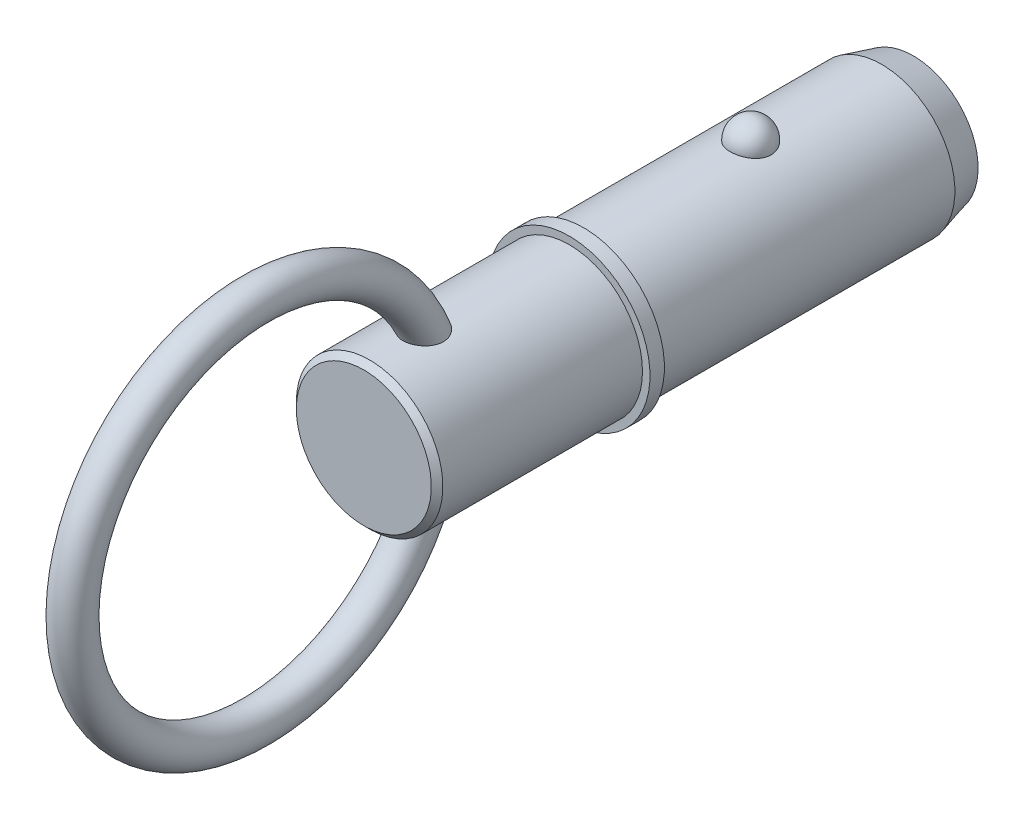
SolidWorks part; units mm, degrees
ref_plane "Front Plane" through (0, 0, 0) normal (0, 0, 1) x (1, 0, 0)
ref_plane "Top Plane" through (0, 0, 0) normal (0, 1, 0) x (1, 0, 0)
ref_plane "Right Plane" through (0, 0, 0) normal (1, 0, 0) x (0, 0, -1)
sketch "Sketch2" plane through (0, 0, 0) normal (0, 0, 1) x (1, 0, 0)
  circle A0 centre (0, 0) radius 12.7
  point P3 (0, 12.7)
  dimension "D1" = 25.4
extrude "Boss-Extrude1" add sketch "Sketch2" along normal blind 25.4
sketch "Sketch3" plane through (0, 0, 0) normal (0, 0, -1) x (-1, 0, 0)
  circle A0 centre (0, 0) radius 12.7
  dimension "D1" = 25.4
extrude "Boss-Extrude2" add sketch "Sketch3" along normal blind 31.75
chamfer "Chamfer1" distance 5.5 angle 15 1 edges at (-12.7, 0, -31.75)
sketch "Sketch18" plane through (0, 0, 0) normal (1, 0, 0) x (0, 0, -1)
  line L0 (26.25, 12.7) -> (-25.4, 12.7) construction
  line L1 (3.56, 16.26) -> (3.56, 9.14)
  line L2 (-25.4, -12.7) -> (26.25, -12.7) construction
  arc A0 (3.56, 16.26) -> (3.56, 9.14) centre (3.56, 12.7) ccw
  point P4 (0, 12.7)
  dimension "D1" = 28.96
revolve "Revolve1" add sketch "Sketch18" angle 360 about L1
sketch "Sketch19" plane through (0, 0, 0) normal (1, 0, 0) x (0, 0, -1)
  line L0 (-33.7288, 0) -> (-46.4542, 0) construction
sketch "Sketch20" plane through (0, 0, 0) normal (1, 0, 0) x (0, 0, -1)
  line L0 (-25.4, 0) -> (-25.4, 14)
  line L1 (-25.4, 12.7) -> (-25.4, -12.7) construction
  line L2 (-25.4, 14) -> (-27.9, 14)
  line L3 (-27.9, 14) -> (-27.9, 0)
  line L4 (-33.7288, 0) -> (-46.4542, 0) construction
  line L5 (-27.9, 0) -> (-25.4, 0)
  dimension "D1" = 14
  dimension "D2" = 2.5
revolve "Revolve2" add sketch "Sketch20" angle 360 about L0
sketch "Sketch21" plane through (0, 0, 25.4) normal (0, 0, -1) x (-1, 0, 0)
  circle A0 centre (0, 0) radius 12.7
  dimension "D1" = 25.4
extrude "Boss-Extrude3" add sketch "Sketch21" against normal blind 38.1
chamfer "Chamfer2" distance 1 angle 45 1 edges at (-12.7, 0, 63.5)
sketch "Sketch23" plane through (0, 0, 0) normal (1, 0, 0) x (0, 0, -1)
  line L0 (-63.5, 11.7) -> (-63.5, -11.7) construction
  circle A0 centre (-82.25, 0) radius 31.75
  point P2 (-50.5, 0)
  dimension "D1" = 63.5
  dimension "D2" = 13
sketch "Sketch24" plane through (0, 0, 0) normal (0, 1, 0) x (1, 0, 0)
  circle A0 centre (0, -50.5) radius 3.25
  dimension "D1" = 6.5
sweep "Sweep1" add profiles "Sketch24" path "Sketch23"
